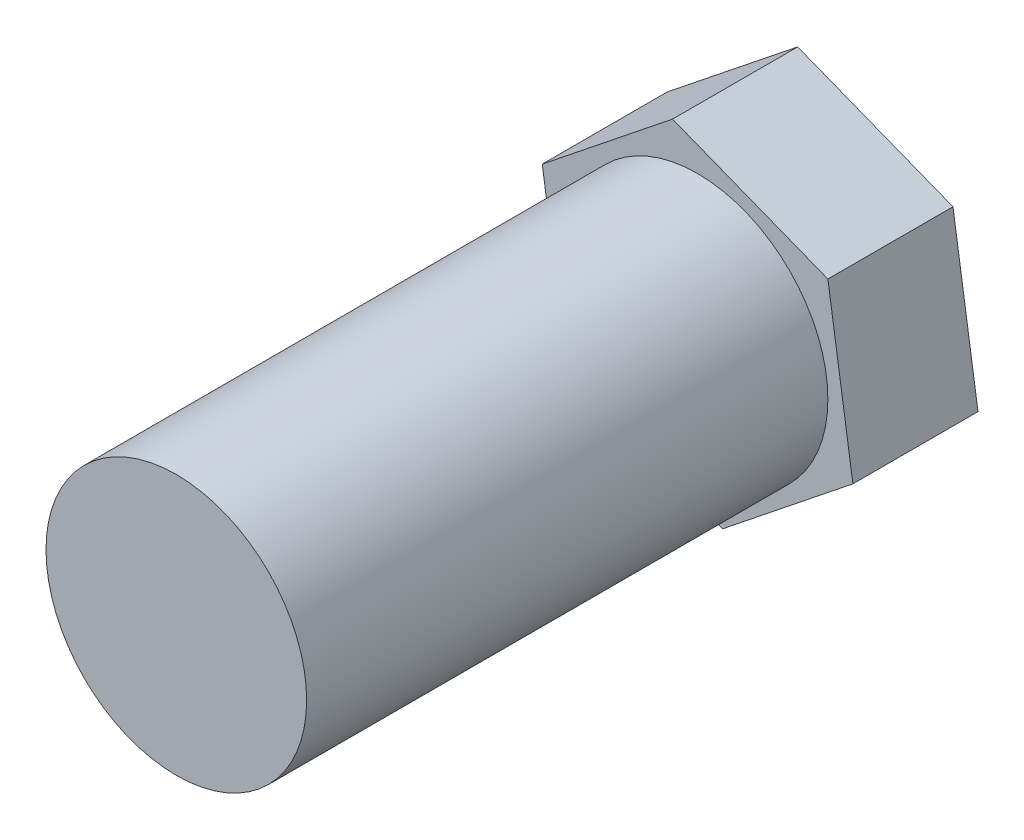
SolidWorks part; units mm, degrees
ref_plane "Alzado" through (0, 0, 0) normal (0, 0, 1) x (1, 0, 0)
ref_plane "Planta" through (0, 0, 0) normal (0, 1, 0) x (1, 0, 0)
ref_plane "Vista lateral" through (0, 0, 0) normal (1, 0, 0) x (0, 0, -1)
sketch "Croquis1" plane through (0, 0, 0) normal (0, 0, 1) x (1, 0, 0)
  circle A0 centre (0, 0) radius 6.25
  dimension "D1" = 12.5
extrude "Saliente-Extruir1" add sketch "Croquis1" along normal blind 25
sketch "Croquis2" plane through (0, 0, 0) normal (0, 0, -1) x (-1, 0, 0)
  line L1 (1.2001, 7.9095) -> (-6.2497, 4.9941)
  line L2 (-6.2497, 4.9941) -> (-7.4499, -2.9154)
  line L3 (-7.4499, -2.9154) -> (-1.2001, -7.9095)
  line L4 (-1.2001, -7.9095) -> (6.2497, -4.9941)
  line L5 (6.2497, -4.9941) -> (7.4499, 2.9154)
  line L6 (7.4499, 2.9154) -> (1.2001, 7.9095)
  circle A1 centre (0, 0) radius 6.9282 construction
  dimension "D1" = 13.8564
extrude "Saliente-Extruir2" add sketch "Croquis2" along normal blind 6
